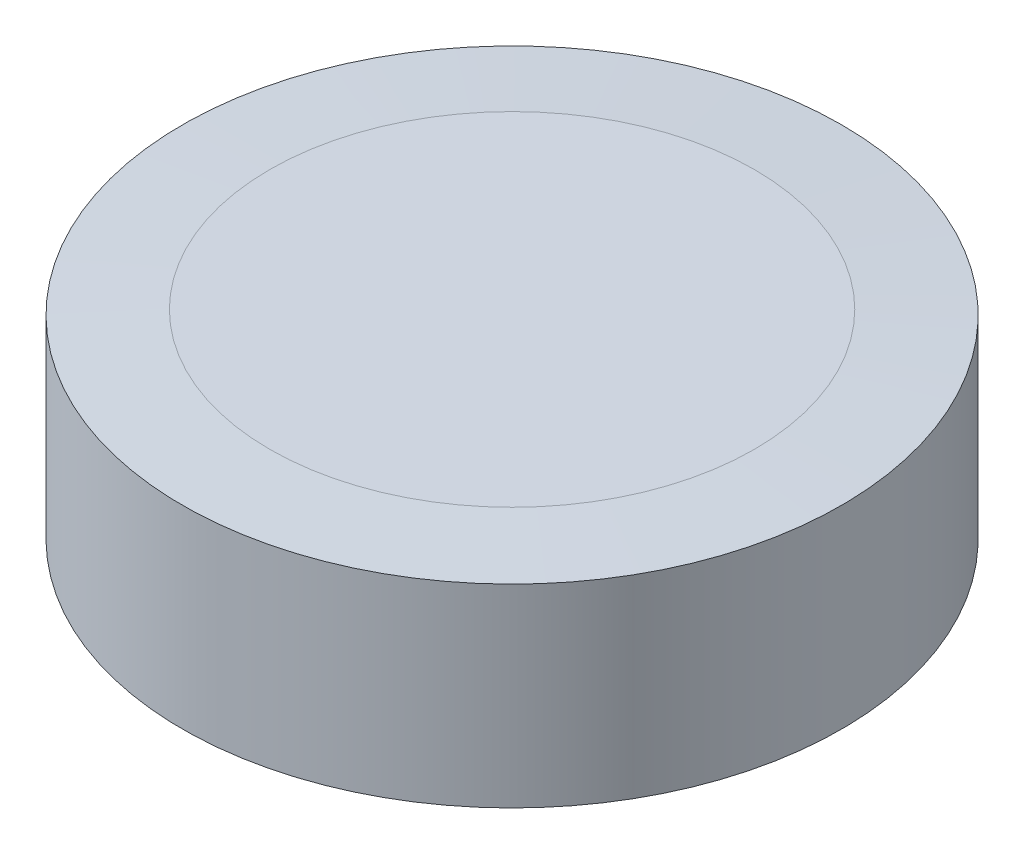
SolidWorks part; units mm, degrees
ref_plane "Front Plane" through (0, 0, 0) normal (0, 0, 1) x (1, 0, 0)
ref_plane "Top Plane" through (0, 0, 0) normal (0, 1, 0) x (1, 0, 0)
ref_plane "Right Plane" through (0, 0, 0) normal (1, 0, 0) x (0, 0, -1)
sketch "Sketch1" plane through (0, 0, 0) normal (0, 0, 1) x (1, 0, 0)
  line L0 (0, -5.25) -> (0, 52.9705) construction
  line L1 (0, 0) -> (-17, 0) construction
  line L2 (0, -5.25) -> (-12.5, -5.25)
  line L3 (0, -5.25) -> (0, 5.25)
  line L4 (0, 5.25) -> (-12.5, 5.25)
  line L5 (-17, -5) -> (-17, 5)
  line L6 (-12.5, 5.25) -> (-12.5, -5.25) construction
  line L7 (-12.5, 5.25) -> (-17, 5)
  line L8 (-12.5, -5.25) -> (-17, -5)
  dimension "D1" = 10.5
  dimension "D2" = 34
  dimension "D3" = 25
  dimension "D4" = 10
revolve "Revolve1" add sketch "Sketch1" angle 360 about L0
